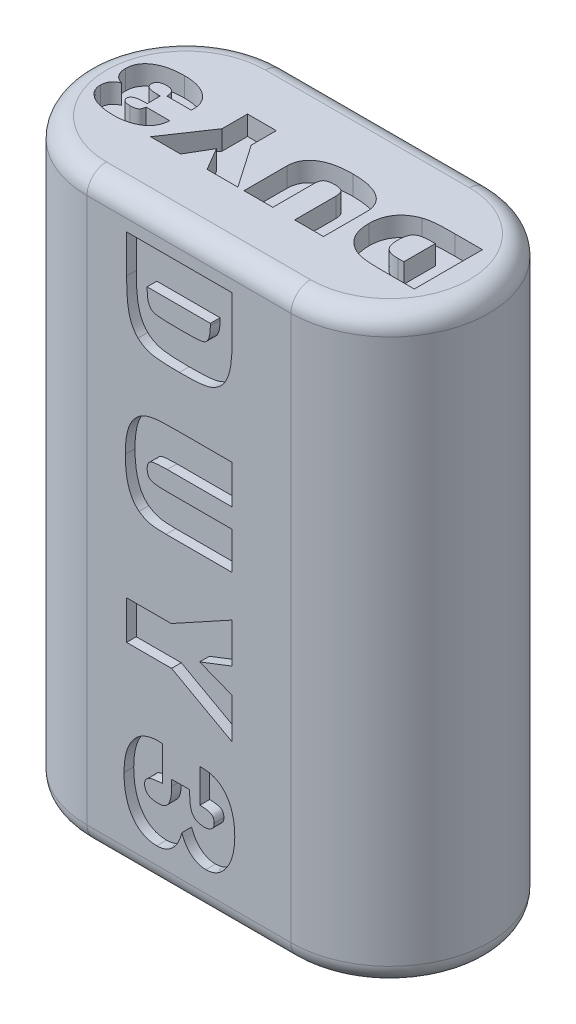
SolidWorks part; units mm, degrees
ref_plane "Front Plane" through (0, 0, 0) normal (0, 0, 1) x (1, 0, 0)
ref_plane "Top Plane" through (0, 0, 0) normal (0, 1, 0) x (1, 0, 0)
ref_plane "Right Plane" through (0, 0, 0) normal (1, 0, 0) x (0, 0, -1)
sketch3d "3DSketch1" plane through (0, 0, 0) normal (0, 0, 1) x (1, 0, 0)
sketch "Main Outline" plane through (0, 0, 0) normal (0, 1, 0) x (1, 0, 0)
  line L6 (15.2562, 6.5669) -> (4.7777, 6.5669) construction
  line L7 (15.2562, 1.4809) -> (4.7777, 1.4809)
  line L8 (15.2562, 11.6529) -> (4.7777, 11.6529)
  arc A0 (15.2562, 1.4809) -> (15.2562, 11.6529) centre (15.2562, 6.5669) ccw
  arc A1 (4.7777, 11.6529) -> (4.7777, 1.4809) centre (4.7777, 6.5669) ccw
  point P5 (10.0169, 6.5669)
sketch "USB Hole" plane through (0, 0, 0) normal (0, -1, 0) x (-1, 0, 0)
  line L5 (-17.4253, 9.8333) -> (-2.6086, 9.8333)
  line L6 (-17.4253, 9.8333) -> (-17.4253, 3.3005)
  line L7 (-17.4253, 3.3005) -> (-2.6086, 3.3005)
  line L8 (-2.6086, 9.8333) -> (-2.6086, 3.3005)
extrude "Boss-Extrude1" add sketch "Main Outline" along normal blind 30
extrude "Cut-Extrude1" cut sketch "USB Hole" against normal blind 5
fillet "Round the bottom" radius 1 4 edges at (-0.3083, 30, -6.5669) (10.0169, 30, -11.6529) (20.3422, 30, -6.5669) (10.0169, 30, -1.4809)
sketch "Bottom Text Line" plane through (0, 30, 0) normal (0, 1, 0) x (1, 0, 0)
  line L0 (19.3422, 8.2327) -> (0.6917, 8.2327)
sketch "Bottom Text" plane through (0, 30, 0) normal (0, 1, 0) x (1, 0, 0)
  text T0 "<b>DUY3</b>" font "Swis721 Blk BT" height 3.5
extrude "Bottom Text Cut" cut sketch "Bottom Text" against normal blind 1
sketch "Side 1 Text Line" plane through (0, 0, -1.4809) normal (0, 0, 1) x (1, 0, 0)
  line L0 (6.8096, 29) -> (6.8096, 0.9843)
sketch "Side 2 Text Line" plane through (0, 0, -11.6529) normal (0, 0, -1) x (-1, 0, 0)
  line L0 (-6.8096, 0.9843) -> (-6.8096, 29)
sketch "Side 1 Text" plane through (0, 0, -1.4809) normal (0, 0, 1) x (1, 0, 0)
  text T0 "<b>DUY3</b>" font "Swis721 BlkCn BT" height in points 20
extrude "Cut Side 1" cut sketch "Side 1 Text" against normal blind 0.5
sketch "Side 2 Text" plane through (0, 0, -11.6529) normal (0, 0, -1) x (-1, 0, 0)
  text T0 "<b>DUY3</b>" font "Swis721 BlkCn BT" height in points 20
extrude "Cut side 2" cut sketch "Side 2 Text" against normal blind 0.5
fillet "Round the top" radius 1 4 edges at (10.0169, 0, -11.6529) (20.3422, 0, -6.5669) (10.0169, 0, -1.4809) (-0.3083, 0, -6.5669)
sketch "Magnet profile" plane through (0, 5, 0) normal (0, -1, 0) x (1, 0, 0)
  line L0 (4.7868, -4.0037) -> (14.89, -4.0037)
  line L1 (4.7868, -4.0037) -> (4.7868, -8.9156)
  line L2 (4.7868, -8.9156) -> (14.89, -8.9156)
  line L3 (14.89, -4.0037) -> (14.89, -8.9156)
  line L4 (4.7868, -4.0037) -> (14.89, -8.9156) construction
  line L5 (4.7868, -8.9156) -> (14.89, -4.0037) construction
  point P0 (9.8384, -6.4596)
extrude "Cut magnet" cut sketch "Magnet profile" against normal blind 19.5
